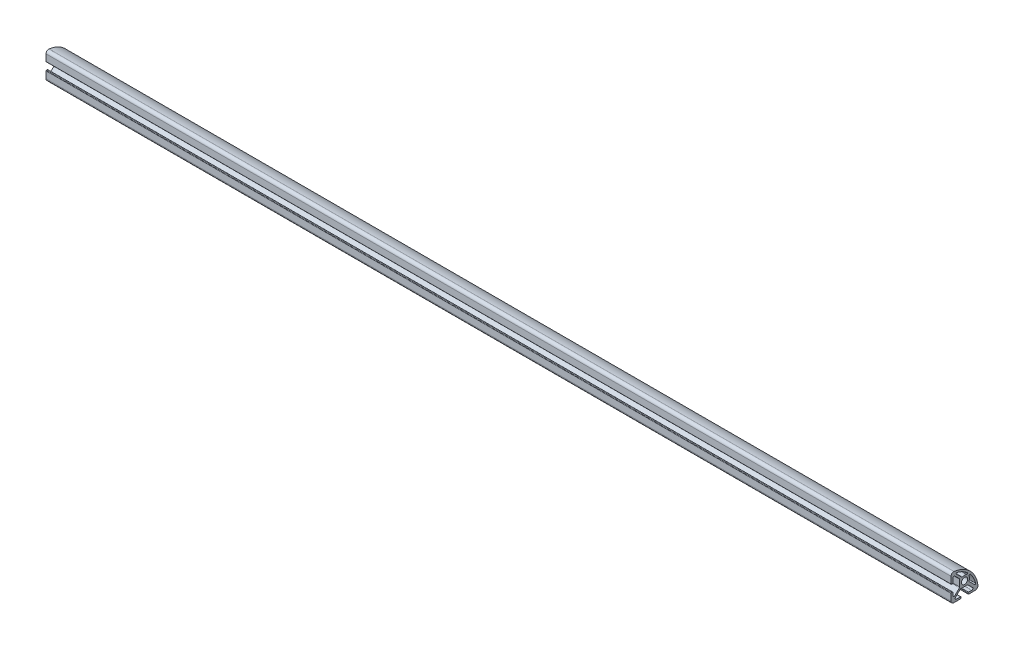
SolidWorks part; units mm, degrees
ref_plane "Ebene vorne" through (0, 0, 0) normal (0, 0, 1) x (1, 0, 0)
ref_plane "Ebene oben" through (0, 0, 0) normal (0, 1, 0) x (1, 0, 0)
ref_plane "Ebene rechts" through (0, 0, 0) normal (1, 0, 0) x (0, 0, -1)
sketch "Skizze1" plane through (0, 0, 0) normal (0, 1, 0) x (1, 0, 0)
  line L0 (0, 0) -> (1000, 0)
  dimension "D1" = 1000
other "Strukturbauteil1"
ref_plane "Ebene1" through (0, 0, 0) normal (1, 0, 0) x (0, 0, -1)
sketch "Model2" plane through (0, 0, 0) normal (1, 0, 0) x (0, 0, -1)
  line L0 (5.0348, -3.0701) -> (11.0393, -9.0746)
  line L1 (-3.0701, 5.0348) -> (-9.0746, 11.0393)
  line L2 (-14.5, 4) -> (-13.5, 4)
  line L3 (-13, 4.5) -> (-13, 9.1023)
  line L4 (-10.7846, 10.0199) -> (-5.6929, 4.9282)
  line L5 (-5.4, 4.2211) -> (-5.4, -3.0211)
  line L6 (-5.6929, -3.7282) -> (-10.7846, -8.8199)
  line L7 (-13, -7.9023) -> (-13, -4.5)
  line L8 (-13.5, -4) -> (-14.5, -4)
  line L9 (-15, -4.5) -> (-15, -12)
  line L10 (-12, -15) -> (-4.5, -15)
  line L11 (-4, -14.5) -> (-4, -13.5)
  line L12 (-4.5, -13) -> (-9.1023, -13)
  line L13 (-10.0199, -10.7846) -> (-4.9282, -5.6929)
  line L14 (-4.2211, -5.4) -> (3.0211, -5.4)
  line L15 (3.7282, -5.6929) -> (8.8199, -10.7846)
  line L16 (7.9023, -13) -> (4.5, -13)
  line L17 (4, -13.5) -> (4, -14.5)
  line L18 (4.5, -15) -> (11.8328, -15)
  line L19 (-15, 11.8328) -> (-15, 4.5)
  line L20 (2.9624, 5.0837) -> (3.1806, 5.3019)
  line L21 (15, 15) -> (-15, 15) construction
  line L22 (15, 15) -> (15, -15) construction
  line L23 (15, -15) -> (-15, -15) construction
  line L24 (-15, 15) -> (-15, -15) construction
  line L25 (15, 15) -> (-15, -15) construction
  line L26 (15, -15) -> (-15, 15) construction
  line L27 (5.0837, 2.9624) -> (5.3019, 3.1806)
  line L28 (-8.464, 12.2247) -> (-8.3664, 12.2029)
  line L29 (3.101, 6.3625) -> (3.176, 6.2964)
  line L30 (6.2964, 3.176) -> (6.3625, 3.101)
  line L31 (12.2029, -8.3664) -> (12.2247, -8.464)
  line L32 (14.8194, -11.7164) -> (14.8086, -11.617)
  line L34 (-11.7164, 14.8194) -> (-11.617, 14.8086)
  circle A0 centre (0, 0) radius 3.4
  arc A1 (-8.3664, 12.2029) -> (3.101, 6.3625) centre (-15, -15) cw
  arc A2 (-11.617, 14.8086) -> (14.8086, -11.617) centre (-15, -15) cw
  arc A3 (5.0348, -3.0701) -> (4.8952, -2.2796) centre (5.5298, -2.5751) cw
  arc A4 (-11.7164, 14.8194) -> (-15, 11.8328) centre (-12, 11.8328) ccw
  arc A5 (14.8194, -11.7164) -> (11.8328, -15) centre (11.8328, -12) cw
  arc A6 (4.9385, 2.1843) -> (4.8952, -2.2796) centre (0, 0) cw
  arc A7 (2.1843, 4.9385) -> (-2.2796, 4.8952) centre (0, 0) ccw
  arc A8 (-8.464, 12.2247) -> (-9.0746, 11.0393) centre (-8.5796, 11.5343) ccw
  arc A9 (5.0837, 2.9624) -> (4.9385, 2.1843) centre (5.5787, 2.4674) ccw
  arc A10 (6.2964, 3.176) -> (5.3019, 3.1806) centre (5.7969, 2.6856) ccw
  arc A11 (-15, 4.5) -> (-14.5, 4) centre (-14.5, 4.5) ccw
  arc A12 (-13.5, 4) -> (-13, 4.5) centre (-13.5, 4.5) ccw
  arc A13 (-10.7846, 10.0199) -> (-13, 9.1023) centre (-11.7023, 9.1023) ccw
  arc A14 (-5.4, 4.2211) -> (-5.6929, 4.9282) centre (-6.4, 4.2211) ccw
  arc A15 (-5.6929, -3.7282) -> (-5.4, -3.0211) centre (-6.4, -3.0211) ccw
  arc A16 (-13, -7.9023) -> (-10.7846, -8.8199) centre (-11.7023, -7.9023) ccw
  arc A17 (-13, -4.5) -> (-13.5, -4) centre (-13.5, -4.5) ccw
  arc A18 (-14.5, -4) -> (-15, -4.5) centre (-14.5, -4.5) ccw
  arc A19 (-15, -12) -> (-12, -15) centre (-12, -12) ccw
  arc A20 (-4.5, -15) -> (-4, -14.5) centre (-4.5, -14.5) ccw
  arc A21 (-4, -13.5) -> (-4.5, -13) centre (-4.5, -13.5) ccw
  arc A22 (-10.0199, -10.7846) -> (-9.1023, -13) centre (-9.1023, -11.7023) ccw
  arc A23 (-4.2211, -5.4) -> (-4.9282, -5.6929) centre (-4.2211, -6.4) ccw
  arc A24 (3.7282, -5.6929) -> (3.0211, -5.4) centre (3.0211, -6.4) ccw
  arc A25 (7.9023, -13) -> (8.8199, -10.7846) centre (7.9023, -11.7023) ccw
  arc A26 (4.5, -13) -> (4, -13.5) centre (4.5, -13.5) ccw
  arc A27 (4, -14.5) -> (4.5, -15) centre (4.5, -14.5) ccw
  arc A28 (-3.0701, 5.0348) -> (-2.2796, 4.8952) centre (-2.5751, 5.5298) ccw
  arc A29 (2.9624, 5.0837) -> (2.1843, 4.9385) centre (2.4674, 5.5787) cw
  arc A30 (3.176, 6.2964) -> (3.1806, 5.3019) centre (2.6856, 5.7969) cw
  arc A31 (12.2029, -8.3664) -> (6.3625, 3.101) centre (-15, -15) ccw
  arc A32 (12.2247, -8.464) -> (11.0393, -9.0746) centre (11.5343, -8.5796) cw
  point P3 (0, 0)
  point P78 (-15, 0)
  point P82 (0, -15)
